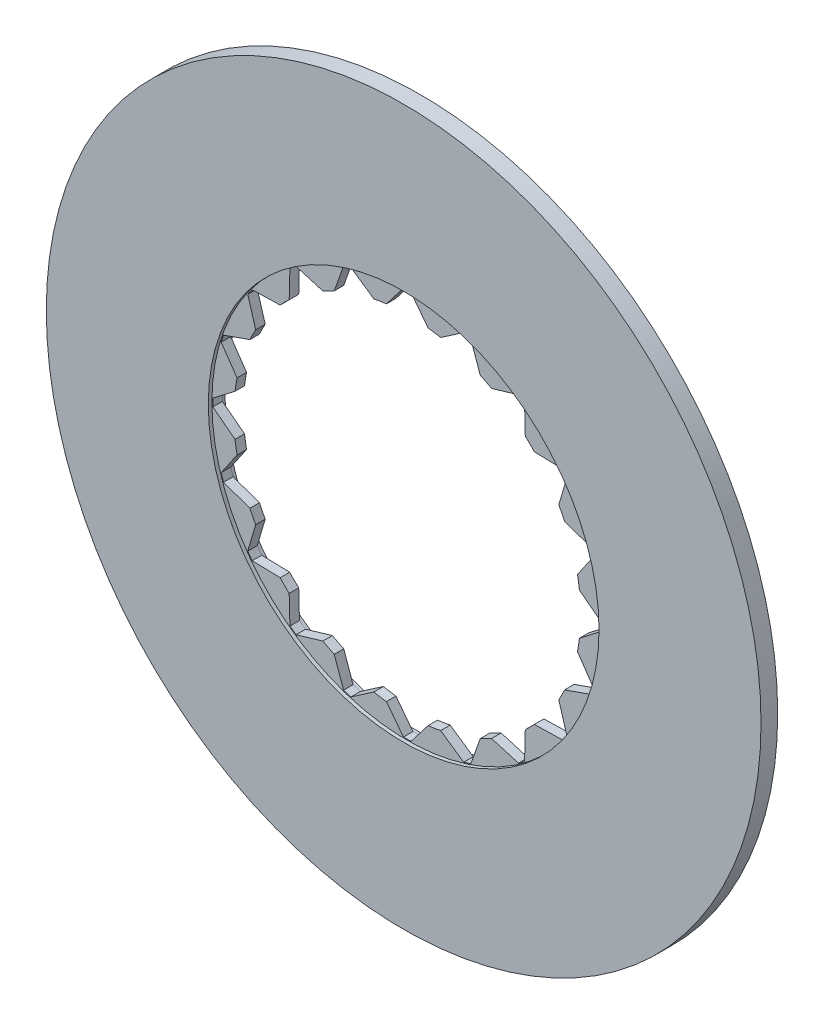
SolidWorks part; units mm, degrees
ref_plane "Plan de face" through (0, 0, 0) normal (0, 0, 1) x (1, 0, 0)
ref_plane "Plan de dessus" through (0, 0, 0) normal (0, 1, 0) x (1, 0, 0)
ref_plane "Plan de droite" through (0, 0, 0) normal (1, 0, 0) x (0, 0, -1)
sketch "Esquisse1" plane through (0, 0, 0) normal (0, 0, 1) x (1, 0, 0)
  circle A0 centre (0, 0) radius 37.5
  dimension "D1" = 75
extrude "Extrusion1" add sketch "Esquisse1" along normal mid plane 1
sketch "Esquisse3" plane through (8.9697, -3.9888, 0.5) normal (0, 0, 1) x (1, 0, 0)
  circle A0 centre (-8.9697, 3.9888) radius 18.2
  dimension "d2 alésage" = 36.4
extrude "Enlèv. mat.-Extru.1" cut sketch "Esquisse3" against normal blind 10
sketch "Esquisse2" plane through (8.9697, -3.9888, 0.5) normal (0, 0, 1) x (1, 0, 0)
  line L0 (-8.9697, 3.9888) -> (-8.9697, 24.3888) construction
  line L1 (-8.572, 24.385) -> (-6.786, 22.0574)
  line L2 (-9.3673, 24.385) -> (-11.1534, 22.0574)
  line L3 (-6.6147, 21.8341) -> (-11.3247, 21.8341) construction
  line L4 (-11.1534, 22.0574) -> (-6.786, 22.0574)
  arc A1 (-8.572, 24.385) -> (-9.3673, 24.385) centre (-8.9697, 3.9888) ccw
  circle A2 centre (-8.9697, 3.9888) radius 18 construction
  arc A3 (-6.786, 22.0574) -> (-11.1534, 22.0574) centre (-8.9697, 3.9888) ccw construction
  dimension "d1 primitif" = 36
  dimension "D2" = 36.4
  dimension "d4 sommet d'alésage" = 40.8
  dimension "p/2 demi pas" = 4.71
  dimension "Angle" = 75
extrude "Enlèv. mat.-Extru.2" cut sketch "Esquisse2" against normal blind 10
pattern_circular "Répétition circulaire1" count 20 over 360 about axis through (0, 0, 0) along (0, 0, 1) of "Enlèv. mat.-Extru.2"
other "Dentelures rectilignes<1>"
sketch "Esquisse4" plane through (0, 0, 0) normal (0, 0, 1) x (1, 0, 0)
  circle A0 centre (0, 0) radius 37.5 construction
  circle A1 centre (0, 0) radius 37.5
  circle A2 centre (0, 0) radius 20.5
  dimension "D1" = 17
extrude "Extrusion2" add sketch "Esquisse4" along normal mid plane 1.75
equation "\"D1@Enlèv. mat.-Extru.2\" = \"Profondeur@Enlèv. mat.-Extru.1\""
equation "\"D2@Esquisse2\" = \"d2 alésage@Esquisse3\""
